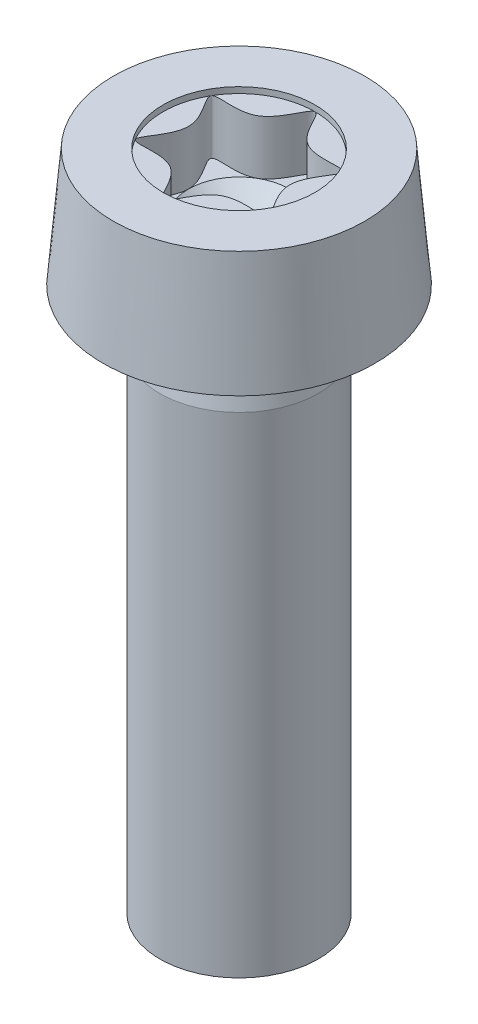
SolidWorks part; units mm, degrees
ref_plane "Front" through (0, 0, 0) normal (0, 0, 1) x (1, 0, 0)
ref_plane "Top" through (0, 0, 0) normal (0, 1, 0) x (1, 0, 0)
ref_plane "Right" through (0, 0, 0) normal (1, 0, 0) x (0, 0, -1)
sketch "Sketch1" plane through (0, 0, 0) normal (0, 0, 1) x (1, 0, 0)
  line L0 (0, 0) -> (0, 5.1006) construction
  line L1 (0, 14.6) -> (2.7725, 14.6)
  line L2 (2.7725, 14.6) -> (3, 12)
  line L3 (3, 12) -> (1.75, 12)
  line L4 (1.75, 0) -> (1.75, 10.8)
  line L5 (1.75, 0) -> (0, 0)
  line L6 (0, 0) -> (0, 14.6)
  line L7 (3, 12) -> (3, 11.4) construction
  line L8 (1.75, 10.8) -> (1.51, 12)
  line L9 (1.51, 12) -> (1.75, 12)
  line L10 (3, 11.4) -> (3, 0.6) construction
revolve "Body-Revolve" add sketch "Sketch1" angle 360 about L0
fillet "Fillet1" radius 0.1 1 edges at (0, 12, -1.51)
sketch "Sketch2" plane through (0, 14.6, 0) normal (0, 1, 0) x (-1, 0, 0)
  line L0 (0, -1.8425) -> (0, 0)
  line L1 (0, 0) -> (-0.8375, -1.4506)
  circle A0 centre (0, 0) radius 1.675
  circle A1 centre (0, 0) radius 1.1167
  spline S0 degree 3 poles (0.3613, -0.6257) (0, -2.1996) (-0.3613, -0.6257) (-1.9049, -1.0998) (-0.7225, 0) (-1.9049, 1.0998) (-0.3613, 0.6257) (0, 2.1996) (0.3613, 0.6257) (1.9049, 1.0998) (0.7225, 0) (1.9049, -1.0998) (0.3613, -0.6257) (0, -2.1996) (-0.3613, -0.6257) knots -0.25 -0.166667 -0.083333 0 0.083333 0.166667 0.25 0.333333 0.416667 0.5 0.583333 0.666667 0.75 0.833333 0.916667 1 1.083333 1.166667 1.25 only from (0, -1.675) to (0, -1.675)
  point P5 (0, -1.675)
  point P7 (-0.5583, -0.9671)
  point P10 (-1.4506, -0.8375)
  point P11 (-1.4506, 0.8375)
  point P12 (0, 1.675)
  point P13 (1.4506, 0.8375)
  point P14 (1.4506, -0.8375)
  point P15 (-1.1167, 0)
  point P16 (-0.5583, 0.9671)
  point P17 (0.5583, 0.9671)
  point P18 (1.1167, 0)
  point P19 (0.5583, -0.9671)
extrude "Socket-Cut-Extrude1" cut sketch "Sketch2" against normal blind 1.33 contours S0
sketch "Sketch3" plane through (0, 14.6, 0) normal (0, 1, 0) x (-1, 0, 0)
  circle A0 centre (0, 0) radius 1.675
extrude "Socket-Cut-Extrude2" cut sketch "Sketch3" against normal blind 0.133
sketch "Sketch4" plane through (0, 0, 0) normal (0, 0, 1) x (1, 0, 0)
  line L0 (0, 13.27) -> (1.1167, 13.27)
  line L1 (1.4569, 13.27) -> (-1.4569, 13.27) construction
  line L2 (1.1167, 13.27) -> (0, 12.26)
  line L3 (0, 0) -> (0, 5.1006) construction
  line L4 (0, 12.26) -> (0, 13.27)
  line L5 (1.675, 14.6) -> (-1.675, 14.6) construction
revolve "Drill-Cut-Revolve" cut sketch "Sketch4" angle 360 about axis through (0, 0, 0) along (0, 1, 0)
sketch "Sketch5" plane through (0, 0, 0) normal (0, 0, 1) x (1, 0, 0)
  line L0 (1.75, 0) -> (1.4252, 0.1875)
  line L1 (1.4252, 0.1875) -> (1.75, 0.375)
  line L2 (1.75, 0) -> (1.75, 10.8) construction
  line L3 (1.75, 0.375) -> (1.75, 0)
  line L4 (0, 0) -> (0, 5.1006) construction
revolve "ThreadSchematic" [suppressed] cut sketch "Sketch5" angle 360 about axis through (0, 0, 0) along (0, 1, 0)
pattern_linear "ThdSchPat" [suppressed] count 56 spacing 0.6 along (0, 1, 0)
equation "\"D2@Sketch1\" = 0.2*\"thread_gap@Sketch1\""
equation "\"D1@Sketch2\" = \"socket_dia@Sketch2\" / 1.5"
equation "\"D2@Sketch2\" = \"socket_dia@Sketch2\" / 2 * 1.1"
equation "\"D1@Sketch3\" =\"socket_dia@Sketch2\""
equation "\"D1@Socket-Cut-Extrude2\" = .1 * \"socket_dep@Socket-Cut-Extrude1\""
equation "\"D1@Sketch4\" = 0.9*\"head_ht@Sketch1\""
equation "\"D2@Sketch4\" = \"D1@Sketch2\" / 2"
equation "\"D1@ThreadCosmetic\" = \"thread_length@Sketch1\""
equation "\"D2@ThreadCosmetic\" = \"dia@Sketch1\" - 1.0825 * \"pitch@Sketch1\""
equation "\"D1@Sketch5\" = \"D2@ThreadCosmetic\" / 2"
equation "\"D3@ThdSchPat\" = \"pitch@Sketch1\""
equation "\"D1@ThdSchPat\" = \"thread_length@Sketch1\" / \"pitch@Sketch1\""
